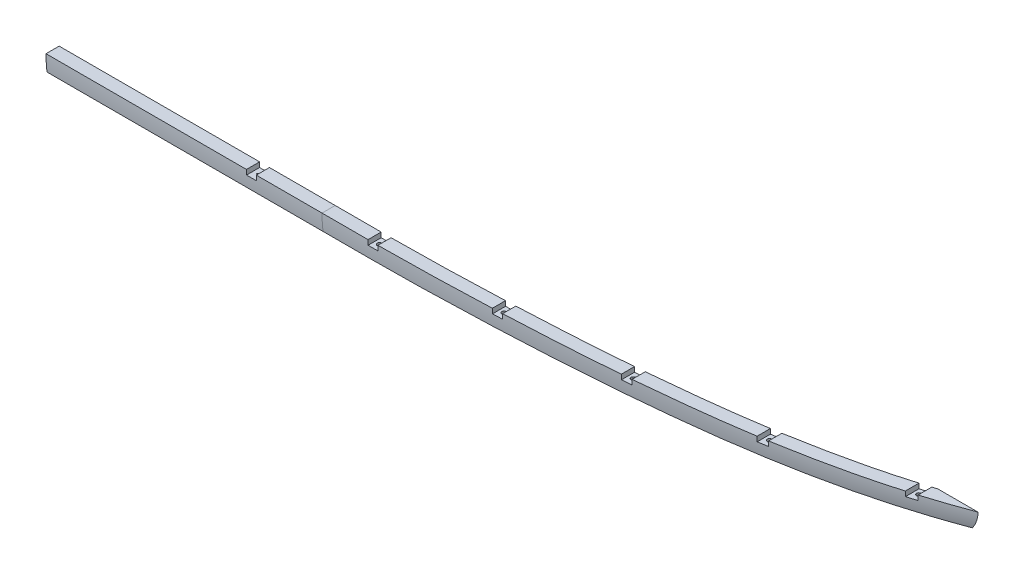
SolidWorks part; units mm, degrees
other "<1 TAIL FLANGE TOP PART>-<<0 TAIL FLANGE BASE PART>-<#8-32 Tapped Hole2>>"
other "<1 TAIL FLANGE TOP PART>-<<0 TAIL FLANGE BASE PART>-<#8-32 Tapped Hole1>>"
ref_plane "FRONT" through (0, 0, 0) normal (0, 0, 1) x (1, 0, 0)
ref_plane "TOP" through (0, 0, 0) normal (0, 1, 0) x (1, 0, 0)
ref_plane "SIDE" through (0, 0, 0) normal (1, 0, 0) x (0, 0, -1)
inserted part "1 TAIL FLANGE TOP PART"
ref_plane "Plane1" through (-101.6, 0, 260.35) normal (0, 0, -1) x (-1, 0, 0)
sketch "Sketch1" plane through (0, -9.525, 0) normal (0, 1, 0) x (-1, 0, 0)
  circle A0 centre (3.175, 247.6509) radius 3.175
  circle A1 centre (3.175, 247.6509) radius 1.7272 construction
  circle A2 centre (-231.775, 241.9424) radius 3.175
  circle A3 centre (-231.775, 241.9424) radius 1.7272 construction
  circle A4 centre (-466.725, 227.1703) radius 3.175
  circle A5 centre (-466.725, 227.1703) radius 1.7272 construction
  circle A6 centre (-701.675, 198.8036) radius 3.175
  circle A7 centre (-701.675, 198.8036) radius 1.7272 construction
  circle A8 centre (-936.625, 145.3725) radius 3.175
  circle A9 centre (-936.625, 145.3725) radius 1.7272 construction
  dimension "D1" = 6.35
extrude "MountingThruHoles" cut sketch "Sketch1" against normal through all
sketch "Sketch2" plane through (0, -9.525, 0) normal (0, 1, 0) x (-1, 0, 0)
  circle A0 centre (3.175, 247.6509) radius 4.3656
  circle A1 centre (3.175, 247.6509) radius 3.175 construction
  circle A2 centre (-231.775, 241.9424) radius 4.3656
  circle A3 centre (-231.775, 241.9424) radius 3.175 construction
  circle A4 centre (-466.725, 227.1703) radius 4.3656
  circle A5 centre (-466.725, 227.1703) radius 3.175 construction
  circle A6 centre (-701.675, 198.8036) radius 4.3656
  circle A7 centre (-701.675, 198.8036) radius 3.175 construction
  circle A8 centre (-936.625, 145.3725) radius 4.3656
  circle A9 centre (-936.625, 145.3725) radius 3.175 construction
  dimension "D1" = 8.7312
extrude "Cut-Extrude1" cut sketch "Sketch2" against normal blind 7.62
sketch "Sketch3" plane through (0, -31.75, 0) normal (0, -1, 0) x (1, 0, 0)
  circle A0 centre (-3.175, 247.6509) radius 6.35
  circle A1 centre (-3.175, 247.6509) radius 3.175 construction
  circle A2 centre (231.775, 241.9424) radius 6.35
  circle A3 centre (231.775, 241.9424) radius 3.175 construction
  circle A4 centre (466.725, 227.1703) radius 6.35
  circle A5 centre (466.725, 227.1703) radius 3.175 construction
  circle A6 centre (701.675, 198.8036) radius 6.35
  circle A7 centre (701.675, 198.8036) radius 3.175 construction
  circle A8 centre (936.625, 145.3725) radius 6.35
  circle A9 centre (936.625, 145.3725) radius 3.175 construction
  dimension "D1" = 12.7
extrude "Cut-Extrude2" cut sketch "Sketch3" against normal blind 6.35
sketch "Sketch4" plane through (-330.2, 0, 0) normal (-1, 0, 0) x (0, 0, 1)
  line L0 (234.9498, -31.75) -> (258.4068, -31.75) construction
  line L1 (260.35, 0) -> (234.9498, 0) construction
  line L2 (234.9498, 0) -> (234.9498, -31.75) construction
  line L3 (234.9498, -31.75) -> (258.4068, -31.75)
  line L4 (260.35, 0) -> (234.9498, 0)
  line L5 (234.9498, 0) -> (234.9498, -31.75)
  arc A0 (258.4068, -31.75) -> (260.35, 0) centre (0, 0) ccw construction
  arc A1 (258.4068, -31.75) -> (260.35, 0) centre (0, 0) ccw
extrude "Extrude1" add sketch "Sketch4" along normal up to surface (304.8 mm away)
